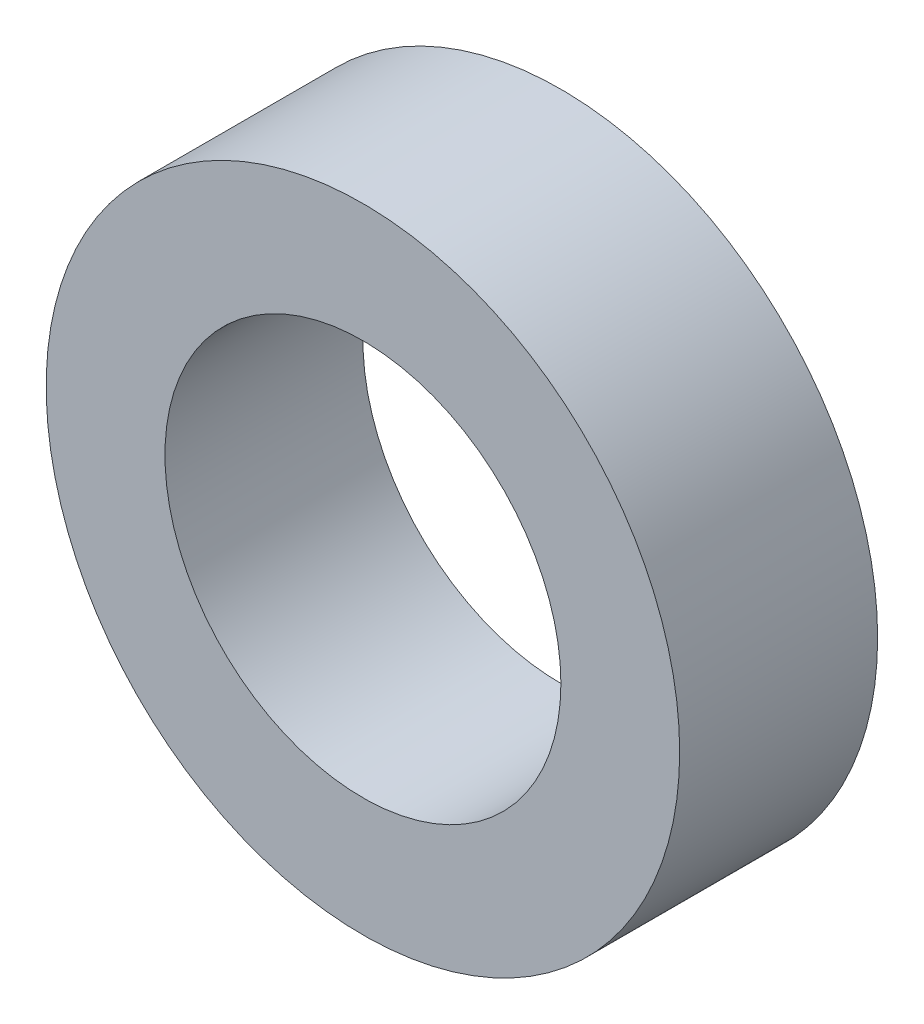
SolidWorks part; units mm, degrees
ref_plane "Plan de face" through (0, 0, 0) normal (0, 0, 1) x (1, 0, 0)
ref_plane "Plan de dessus" through (0, 0, 0) normal (0, 1, 0) x (1, 0, 0)
ref_plane "Plan de droite" through (0, 0, 0) normal (1, 0, 0) x (0, 0, -1)
sketch "Esquisse1" plane through (0, 0, 0) normal (0, 0, 1) x (1, 0, 0)
  circle A0 centre (0, 0) radius 5
  circle A1 centre (0, 0) radius 8
  dimension "D1" = 16
  dimension "D2" = 10
extrude "Extrusion1" add sketch "Esquisse1" along normal blind 5
